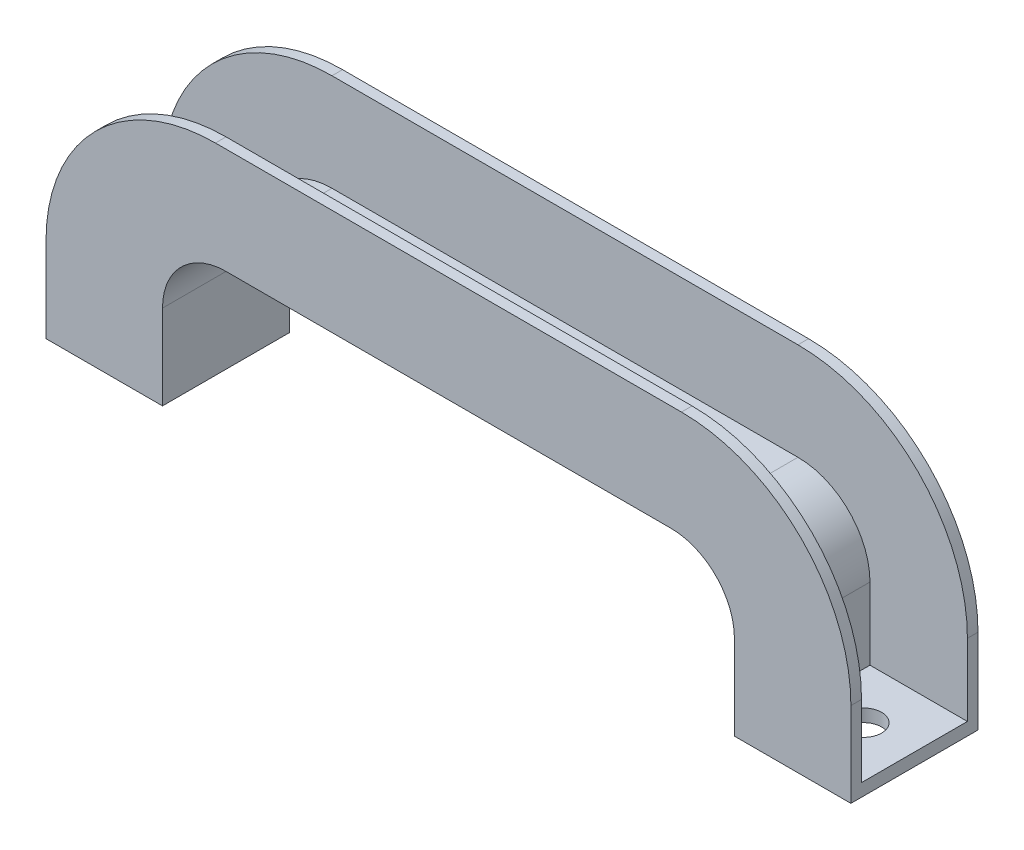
SolidWorks part; units mm, degrees
ref_plane "Face" through (0, 0, 0) normal (0, 0, 1) x (1, 0, 0)
ref_plane "Dessus" through (0, 0, 0) normal (0, 1, 0) x (1, 0, 0)
ref_plane "Droite" through (0, 0, 0) normal (1, 0, 0) x (0, 0, -1)
sketch "Esquisse1" plane through (0, 0, 0) normal (0, 0, 1) x (1, 0, 0)
  line L0 (0, 0) -> (0, 20)
  line L1 (40, 60) -> (150, 60)
  line L2 (190, 20) -> (190, 0)
  line L3 (190, 0) -> (162.5, 0)
  line L4 (162.5, 0) -> (162.5, 20)
  line L5 (147.5, 35) -> (42.5, 35)
  line L6 (27.5, 20) -> (27.5, 0)
  line L7 (27.5, 0) -> (0, 0)
  arc A0 (0, 20) -> (40, 60) centre (40, 20) cw
  arc A1 (150, 60) -> (190, 20) centre (150, 20) cw
  arc A2 (42.5, 35) -> (27.5, 20) centre (42.5, 20) ccw
  arc A3 (162.5, 20) -> (147.5, 35) centre (147.5, 20) ccw
  dimension "D1" = 40
  dimension "D6" = 15
  dimension "D2" = 190
  dimension "D3" = 135
  dimension "D4" = 60
  dimension "D5" = 35
extrude "Base-Extrusion" add sketch "Esquisse1" along normal mid plane 30
sketch "Esquisse2" plane through (0, 0, 0) normal (0, 0, 1) x (1, 0, 0)
  line L3 (23, 20) -> (23, 3)
  line L4 (150, 37) -> (40, 37)
  line L5 (150, 37) -> (40, 37)
  line L6 (23, 3) -> (-29.7775, 3)
  line L7 (-29.7775, 3) -> (-26.8678, 105.6032)
  line L8 (-26.8678, 105.6032) -> (213.5212, 95.5392)
  line L9 (213.5212, 95.5392) -> (209.647, 3)
  line L10 (209.647, 3) -> (167, 3)
  line L11 (167, 3) -> (167, 20)
  line L12 (0, 0) -> (27.5, 0) construction
  arc A5 (167, 20) -> (150, 37) centre (150, 20) ccw
  arc A6 (40, 37) -> (23, 20) centre (40, 20) ccw
  arc A7 (167, 20) -> (150, 37) centre (150, 20) ccw
  arc A8 (40, 37) -> (23, 20) centre (40, 20) ccw
  dimension "D2" = 3
  dimension "D1" = 23
extrude "Enlèv. mat.-Extru.1" cut sketch "Esquisse2" against normal mid plane 25
sketch "Esquisse3" plane through (0, 0, 0) normal (0, -1, 0) x (1, 0, 0)
  line L0 (0, 0) -> (210.2014, 0) construction
  line L1 (0, 15) -> (0, -15) construction
  line L2 (190, 15) -> (190, -15) construction
  circle A0 centre (12, 0) radius 4.25
  circle A1 centre (178, 0) radius 4.25
  dimension "D1" = 8.5
  dimension "D3" = 12
  dimension "D2" = 12
extrude "Enlèv. mat.-Extru.3" cut sketch "Esquisse3" against normal through all
